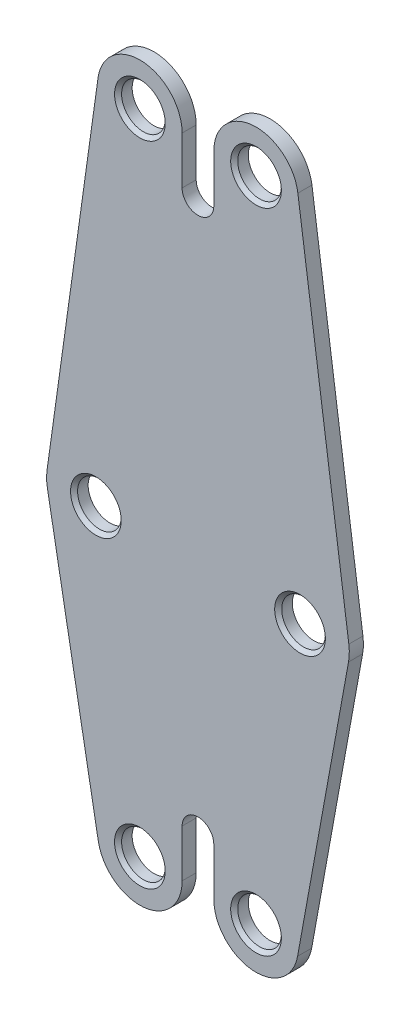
SolidWorks part; units mm, degrees
ref_plane "Face" through (0, 0, 0) normal (0, 0, 1) x (1, 0, 0)
ref_plane "Dessus" through (0, 0, 0) normal (0, 1, 0) x (1, 0, 0)
ref_plane "Droite" through (0, 0, 0) normal (1, 0, 0) x (0, 0, -1)
sketch "Esquisse1" plane through (0, 0, 0) normal (0, 0, 1) x (1, 0, 0)
  line L0 (0, 0) -> (0, 73.8116) construction
  line L1 (2.25, 45.25) -> (2.25, 52)
  line L2 (-2.25, 45.25) -> (-2.25, 52)
  line L3 (2.25, -33.25) -> (2.25, -40)
  line L4 (-2.25, -33.25) -> (-2.25, -40)
  line L5 (-14.1924, 52.8296) -> (-21.4328, 0.9679)
  line L6 (14.1924, 52.8296) -> (21.4328, 0.9679)
  line L7 (21.3873, -1.2511) -> (14.1534, -41.0724)
  line L8 (-21.3873, -1.2511) -> (-14.1534, -41.0724)
  circle A0 centre (-8.25, 52) radius 3.1
  circle A1 centre (8.25, 52) radius 3.1
  circle A2 centre (-14.5, 0) radius 3.1
  circle A3 centre (14.5, 0) radius 3.1
  circle A4 centre (-8.25, -40) radius 3.1
  circle A5 centre (8.25, -40) radius 3.1
  arc A6 (-2.25, 52) -> (-14.1924, 52.8296) centre (-8.25, 52) ccw
  arc A7 (14.1924, 52.8296) -> (2.25, 52) centre (8.25, 52) ccw
  arc A8 (21.3873, -1.2511) -> (21.4328, 0.9679) centre (14.5, 0) ccw
  arc A9 (-21.4328, 0.9679) -> (-21.3873, -1.2511) centre (-14.5, 0) ccw
  arc A10 (-14.1534, -41.0724) -> (-2.25, -40) centre (-8.25, -40) ccw
  arc A11 (2.25, -40) -> (14.1534, -41.0724) centre (8.25, -40) ccw
  arc A12 (2.25, 45.25) -> (-2.25, 45.25) centre (0, 45.25) cw
  arc A13 (2.25, -33.25) -> (-2.25, -33.25) centre (0, -33.25) ccw
  dimension "D1" = 6.2
  dimension "D8" = 6
  dimension "D9" = 7
  dimension "D10" = 2.25
  dimension "D2" = 14.5
  dimension "D3" = 29
  dimension "D4" = 52
  dimension "D5" = 8.25
  dimension "D6" = 16.5
  dimension "D7" = 40
  dimension "D11" = 6.75
  dimension "D12" = 6.75
extrude "Base-Extrusion" add sketch "Esquisse1" along normal blind 2
chamfer "Chanfrein1" distance 0.5 angle 45 6 edges at (-5.15, 52, 2) (11.35, 52, 2) (-11.4, 0, 2) (17.6, 0, 2) (-5.15, -40, 2) (11.35, -40, 2)
sketch "Esquisse2" plane through (0, 0, 2) normal (0, 0, 1) x (1, 0, 0)
  line L0 (-14.1924, 52.8296) -> (-21.4328, 0.9679) construction
  line L1 (-4.1844, 47.2996) -> (-3.9824, 47.2996)
  line L2 (-4.1844, 47.2996) -> (-5.5671, 37.3956)
  line L3 (-5.5671, 37.3956) -> (-5.3651, 37.3956)
  line L4 (-3.9824, 47.2996) -> (-5.3651, 37.3956)
  line L5 (5.3939, 48.3104) -> (5.5985, 48.3104)
  line L6 (5.3939, 48.3104) -> (4.5435, 44.3589)
  line L7 (4.5435, 44.3589) -> (4.748, 44.3589)
  line L8 (5.5985, 48.3104) -> (4.748, 44.3589)
  line L9 (11.2346, 48.1296) -> (11.4352, 48.1296)
  line L10 (11.2346, 48.1296) -> (12.052, 38.1631)
  line L11 (12.052, 38.1631) -> (12.2527, 38.1631)
  line L12 (11.4352, 48.1296) -> (12.2527, 38.1631)
  line L13 (2.608, 40.7068) -> (2.0449, 40.7068)
  line L14 (2.608, 40.7068) -> (-1.6163, 42.3117)
  line L15 (-1.6163, 42.3117) -> (-2.1794, 42.3117)
  line L16 (2.0449, 40.7068) -> (-2.1794, 42.3117)
  line L17 (-8.2253, -19.2778) -> (-8.0142, -19.2778)
  line L18 (-8.2253, -19.2778) -> (-11.4314, -28.7499)
  line L19 (-11.4314, -28.7499) -> (-11.2203, -28.7499)
  line L20 (-8.0142, -19.2778) -> (-11.2203, -28.7499)
  line L21 (0, -17.6728) -> (0.2497, -17.6728)
  line L22 (0, -17.6728) -> (-6.2222, -25.9972)
  line L23 (-6.2222, -25.9972) -> (-5.9725, -25.9972)
  line L24 (0.2497, -17.6728) -> (-5.9725, -25.9972)
  line L25 (11.034, -22.0864) -> (11.2812, -22.0864)
  line L26 (11.034, -22.0864) -> (5.1537, -30.1748)
  line L27 (5.1537, -30.1748) -> (5.4009, -30.1748)
  line L28 (11.2812, -22.0864) -> (5.4009, -30.1748)
  line L29 (-8.1576, -29.6493) -> (-8.9002, -29.6493)
  line L30 (-8.1576, -29.6493) -> (-1.5074, -27.7895)
  line L31 (-1.5074, -27.7895) -> (-2.25, -27.7895)
  line L32 (-8.9002, -29.6493) -> (-2.25, -27.7895)
  dimension "D1" = 0.2
  dimension "D2" = 10
  dimension "D3" = 0.2
  dimension "D4" = 0.2
  dimension "D5" = 10
  dimension "D6" = 0.2
  dimension "D7" = 0.2
  dimension "D8" = 10
  dimension "D9" = 0.2
  dimension "D10" = 0.2
  dimension "D11" = 10
  dimension "D12" = 0.2
extrude "Enlèv. mat.-Extru.1" cut sketch "Esquisse2" against normal blind 0.1
